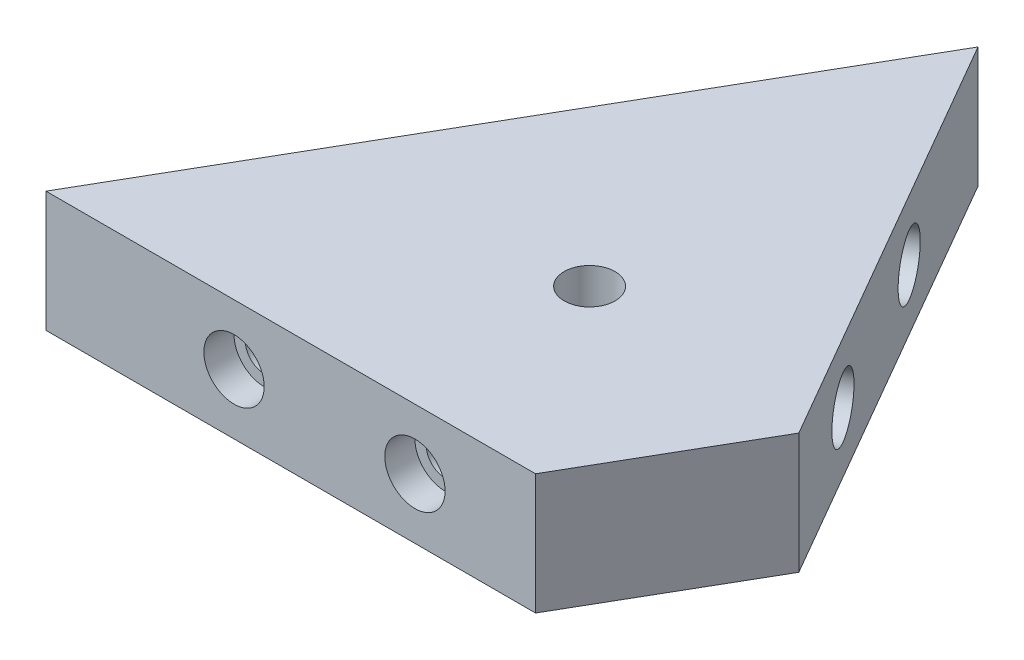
SolidWorks part; units mm, degrees
ref_plane "Front Plane" through (0, 0, 0) normal (0, 0, 1) x (1, 0, 0)
ref_plane "Top Plane" through (0, 0, 0) normal (0, 1, 0) x (1, 0, 0)
ref_plane "Right Plane" through (0, 0, 0) normal (1, 0, 0) x (0, 0, -1)
sketch "Sketch1" plane through (0, 0, 0) normal (0, 1, 0) x (1, 0, 0)
  line L0 (159.6594, -241.1624) -> (-297.5406, 22.8022) construction
  line L1 (-145.1406, 286.7667) -> (-449.9406, -241.1624) construction
  line L2 (-449.9406, -241.1624) -> (159.6594, -241.1624) construction
  line L3 (159.6594, -241.1624) -> (-145.1406, 286.7667) construction
  line L4 (93.6683, -241.1624) -> (93.6683, -203.0624) construction
  line L5 (119.0683, -241.1624) -> (129.2161, -223.5859)
  line L6 (55.5683, -241.1624) -> (55.5683, -181.0653) construction
  line L7 (15.9736, -241.1624) -> (51.8951, -178.9446)
  line L8 (15.9736, -241.1624) -> (119.0683, -241.1624)
  line L9 (51.8951, -178.9446) -> (129.2161, -223.5859)
  line L10 (93.6683, -203.0624) -> (55.5683, -203.0624) construction
  dimension "D1" = 609.6
  dimension "D2" = 38.1
  dimension "D3" = 25.4
  dimension "D4" = 38.1
  dimension "D5" = 15.24
  dimension "D6" = 40.5911
  dimension "D7" = 103.0947
  dimension "D8" = 60
  dimension "D9" = 120
extrude "Boss-Extrude1" add sketch "Sketch1" along normal blind 25.4
sketch "Sketch2" plane through (0, 0, 241.1624) normal (0, 0, 1) x (1, 0, 0)
  line L0 (15.9736, 0) -> (119.0683, 0) construction
  line L1 (15.9736, 0) -> (15.9736, 25.4) construction
  line L2 (119.0683, 0) -> (119.0683, 25.4) construction
  line L3 (15.9736, 25.4) -> (119.0683, 25.4) construction
  line L4 (15.9736, 0) -> (119.0683, 25.4) construction
  line L5 (119.0683, 0) -> (15.9736, 25.4) construction
  line L6 (93.6683, 25.4) -> (93.6683, 0) construction
  line L7 (55.5683, 0) -> (55.5683, 25.4) construction
  circle A0 centre (55.5683, 12.7) radius 6.35
  circle A1 centre (93.6683, 12.7) radius 6.35
  point P6 (67.521, 12.7)
  dimension "D4" = 12.7
  dimension "D5" = 12.7
  dimension "D1" = 25.4
  dimension "D2" = 25.4
  dimension "D3" = 38.1
extrude "Cut-Extrude1" cut sketch "Sketch2" against normal blind 6.35
hole_wizard "3/8-16 Tapped Hole1" positions "Sketch8" profile "Sketch9" tap size "3/8-16" standard "ANSI Inch"
sketch "Sketch8" plane through (0, 0, 234.8124) normal (0, 0, 1) x (1, 0, 0)
  point P0 (93.6683, 12.7)
  point P3 (55.5683, 12.7)
sketch "Sketch9" plane through (93.6683, 12.7, 234.8124) normal (1, 0, 0) x (0, -1, 0)
  line L0 (0, 0) -> (0, 18.2597)
  line L1 (0, 18.2597) -> (3.9687, 15.875)
  line L2 (3.9687, 15.875) -> (3.9687, 0)
  line L5 (3.9687, 0) -> (0, 0)
  line L10 (0, 18.2597) -> (-3.9688, 15.875) construction
  line L11 (0, -6.35) -> (0, 107.95) construction
  dimension "Tap Drill Dia." = 7.9375
  dimension "Tap Drill Depth" = 15.875
  dimension "Drill Angle" = 118
mirror "Mirror1" about plane through (51.8951, 25.4, 178.9446) normal (-0.5, 0, 0.866) of "Boss-Extrude1", "Cut-Extrude1"
sketch "Sketch5" plane through (0, 25.4, 0) normal (0, 1, 0) x (1, 0, 0)
  line L0 (87.8165, -116.7268) -> (15.9736, -241.1624) construction
  line L1 (15.9736, -241.1624) -> (119.0683, -241.1624) construction
  line L2 (119.0683, -241.1624) -> (139.3639, -206.0094) construction
  line L3 (139.3639, -206.0094) -> (87.8165, -116.7268) construction
  line L4 (51.8951, -178.9446) -> (129.2161, -223.5859) construction
  point P13 (90.5556, -201.2653)
  point P15 (90.5556, -201.2653)
  dimension "D3" = 71.8429
hole_wizard "1/2-13 Tapped Hole1" positions "Sketch5" profile "Sketch7" tap size "1/2-13" standard "ANSI Inch"
sketch "Sketch7" plane through (90.5556, 25.4, 201.2653) normal (1, 0, 0) x (0, 0, 1)
  line L0 (0, 0) -> (0, 25.4)
  line L1 (0, 25.4) -> (5.3581, 25.4)
  line L2 (5.3581, 25.4) -> (5.3581, 0)
  line L5 (5.3581, 0) -> (0, 0)
  line L11 (0, -6.35) -> (0, 107.95) construction
  dimension "Thru Tap Drill Dia." = 10.7163
  dimension "Thru Tap Drill Depth" = 25.4
hole_wizard "3/8-16 Tapped Hole2" positions "Sketch10" profile "Sketch11" tap size "3/8-16" standard "ANSI Inch"
sketch "Sketch10" plane through (9.8189, 0, -5.669) normal (0.866, 0, -0.5) x (-0.5, 0, -0.866)
  point P0 (-184.5913, 12.7)
  point P3 (-222.6913, 12.7)
sketch "Sketch11" plane through (102.1146, 12.7, 154.1918) normal (0, 1, 0) x (-0.5, 0, -0.866)
  line L0 (0, 0) -> (0, 18.2597)
  line L1 (0, 18.2597) -> (3.9687, 15.875)
  line L2 (3.9687, 15.875) -> (3.9687, 0)
  line L5 (3.9687, 0) -> (0, 0)
  line L10 (0, 18.2597) -> (-3.9688, 15.875) construction
  line L11 (0, -6.35) -> (0, 107.95) construction
  dimension "Tap Drill Dia." = 7.9375
  dimension "Tap Drill Depth" = 15.875
  dimension "Drill Angle" = 118
